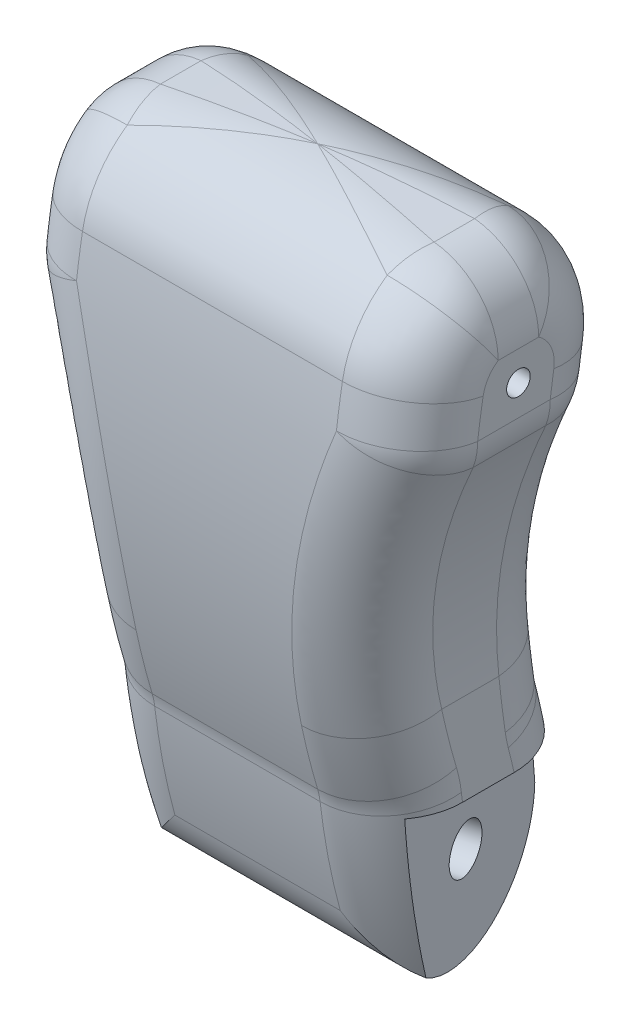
SolidWorks part; units mm, degrees
ref_plane "XY" through (0, 0, 0) normal (0, 0, 1) x (1, 0, 0)
ref_plane "YZ" through (0, 0, 0) normal (0, 1, 0) x (1, 0, 0)
ref_plane "XZ" through (0, 0, 0) normal (1, 0, 0) x (0, 0, -1)
sketch "Sketch1" plane through (0, 0, 0) normal (0, 0, 1) x (1, 0, 0)
  line L0 (-165.1, -120.65) -> (165.1, -120.65) construction
  line L1 (-215.9, 146.05) -> (215.9, 146.05) construction
  line L2 (-165.1, -120.65) -> (-165.1, -292.1)
  line L3 (-165.1, -292.1) -> (165.1, -292.1)
  line L4 (165.1, -120.65) -> (165.1, -292.1)
  line L5 (-215.9, 292.1) -> (215.9, 292.1) construction
  line L6 (-215.9, 292.1) -> (-215.9, 146.05)
  line L7 (0, -281.3272) -> (0, 281.3272) construction
  line L8 (215.9, 292.1) -> (215.9, 146.05)
  line L9 (272.0816, 0) -> (-272.0816, 0) construction
  arc A0 (215.9, 146.05) -> (165.1, -120.65) centre (890.5875, -120.65) ccw
  arc A1 (-215.9, 146.05) -> (-165.1, -120.65) centre (-890.5875, -120.65) cw
  arc A2 (-215.9, 292.1) -> (215.9, 292.1) centre (0, -1216.5296) cw
  dimension "D9" = 1524
  dimension "D1" = 215.9
  dimension "D2" = 215.9
  dimension "D3" = 292.1
  dimension "D4" = 165.1
  dimension "D5" = 165.1
  dimension "D6" = 146.05
  dimension "D7" = 120.65
  dimension "D8" = 146.05
extrude "Base-Extrude" add sketch "Sketch1" along normal mid plane 241.3
sketch "Sketch14" plane through (0, 0, 0) normal (1, 0, 0) x (0, 0, -1)
  line L8 (-120.65, -292.1) -> (120.65, -292.1) construction
  line L9 (-120.65, 146.05) -> (-120.65, -120.65) construction
  line L10 (120.65, -292.1) -> (120.65, -120.65) construction
  line L11 (120.65, 307.4704) -> (-120.65, 307.4704) construction
  line L12 (-120.65, 146.05) -> (-120.65, 292.1) construction
  line L14 (120.65, 146.05) -> (120.65, 292.1) construction
  line L15 (0, 143.8329) -> (0, 0) construction
  line L16 (0, -151.2422) -> (0, 0) construction
  arc A0 (92.0728, 98.1464) -> (75.7214, -72.3986) centre (470.3262, -24.1758) ccw
  ellipse E0 centre (0, 143.8329) end of major axis (-77.9681, -13.2976) minor radius 102.7845
  ellipse E1 centre (0, -151.2422) end of major axis (77.9824, -280.7299) minor radius 107.4664
ref_plane "Leg-plane" through (114.3, 0, 0) normal (1, 0, 0) x (0, 0, -1)
ref_plane "Arm-plane" through (254, 0, 0) normal (1, 0, 0) x (0, 0, -1)
sketch "Sketch3" plane through (0, 0, 0) normal (1, 0, 0) x (0, 0, -1)
  line L0 (-120.65, -292.1) -> (120.65, -292.1) construction
  line L1 (120.65, 307.4704) -> (-120.65, 307.4704) construction
  line L4 (120.65, -292.1) -> (120.65, -120.65) construction
  line L5 (-120.65, 146.05) -> (-120.65, -120.65) construction
  line L6 (120.65, 146.05) -> (120.65, 292.1) construction
  arc A0 (119.3036, 175.2362) -> (-107.0667, 212.4585) centre (5.9396, 192.7601) ccw
  arc A1 (-77.7875, -221.2418) -> (119.4449, -174.898) centre (19.05, -190.5) ccw
  arc A2 (119.4449, -174.898) -> (119.3036, 175.2362) centre (1248.8875, 0.625) cw
  arc A3 (-107.0667, 212.4585) -> (-77.7875, -221.2418) centre (793.75, 55.4344) ccw
  dimension "D1" = 1143
  dimension "D2" = 914.4
  dimension "D4" = 101.6
extrude "chest" cut sketch "Sketch3" against normal through all and the other way through all flip side to cut
sketch "Sketch2" plane through (0, 0, 0) normal (1, 0, 0) x (0, 0, -1)
  line L1 (39.4667, -302.9618) -> (19.05, -190.5) construction
  line L2 (0, 432.2232) -> (0, -432.2232) construction
  arc A0 (117.0705, -163.769) -> (-82.1115, -199.9292) centre (19.05, -190.5) ccw
  arc A1 (-58.5537, -329.6928) -> (140.6282, -293.5325) centre (39.4667, -302.9618) ccw
  arc A2 (140.6282, -293.5325) -> (117.0705, -163.769) centre (-618.0831, -364.2516) ccw
  arc A3 (-82.1115, -199.9292) -> (-58.5537, -329.6928) centre (676.5998, -129.2101) ccw
  dimension "D2" = 101.6
  dimension "D3" = 101.6
  dimension "D4" = 762
  dimension "D5" = 762
  dimension "D1" = 114.3
  dimension "D6" = 10.29
extrude "hips" add sketch "Sketch2" along normal mid plane 330.2
fillet "Fillet32" radius 76.2
ref_plane "Plane1" through (0, -408.94, 0) normal (0, 1, 0) x (-1, 0, 0)
sketch "Sketch15" plane through (0, -408.94, 0) normal (0, 1, 0) x (-1, 0, 0)
  line L0 (-170.18, 127) -> (-170.18, -189.6815)
  line L1 (-170.18, -189.6815) -> (-85.3255, -189.6815)
  line L2 (-85.3255, -189.6815) -> (-170.18, 127)
  line L3 (-165.1, 58.5537) -> (-165.1, -141.0667) construction
  dimension "D1" = 15
  dimension "D2" = 5.08
  dimension "D3" = 127
extrude "Cut-Extrude1" cut sketch "Sketch15" along normal blind 190.5
sketch "Sketch16" plane through (127.0301, 0, -34.0376) normal (0.9659, 0, -0.2588) x (-0.2588, 0, -0.9659)
  circle A0 centre (5.6206, -302.9618) radius 24.9548
  ellipse E0 centre (5.6206, -302.9618) end of major axis (-99.5634, -302.9618) minor radius 101.6 (-95.8576, -329.6928) -> (110.3507, -293.5325) ccw construction
extrude "Cut-Extrude2" cut sketch "Sketch16" against normal blind 50.8
mirror "Mirror1" about plane through (0, 0, 0) normal (1, 0, 0)
fillet "Fillet33" radius 76.2
sketch "Sketch17" plane through (-215.9, 0, 0) normal (-1, 0, 0) x (0, 0, 1)
  circle A1 centre (-5.9396, 192.7601) radius 12.7
  arc A2 (107.0667, 212.4585) -> (58.958, 287.3474) centre (-5.9396, 192.7601) ccw construction
  dimension "D1" = 25.4
extrude "Cut-Extrude3" cut sketch "Sketch17" against normal through all
